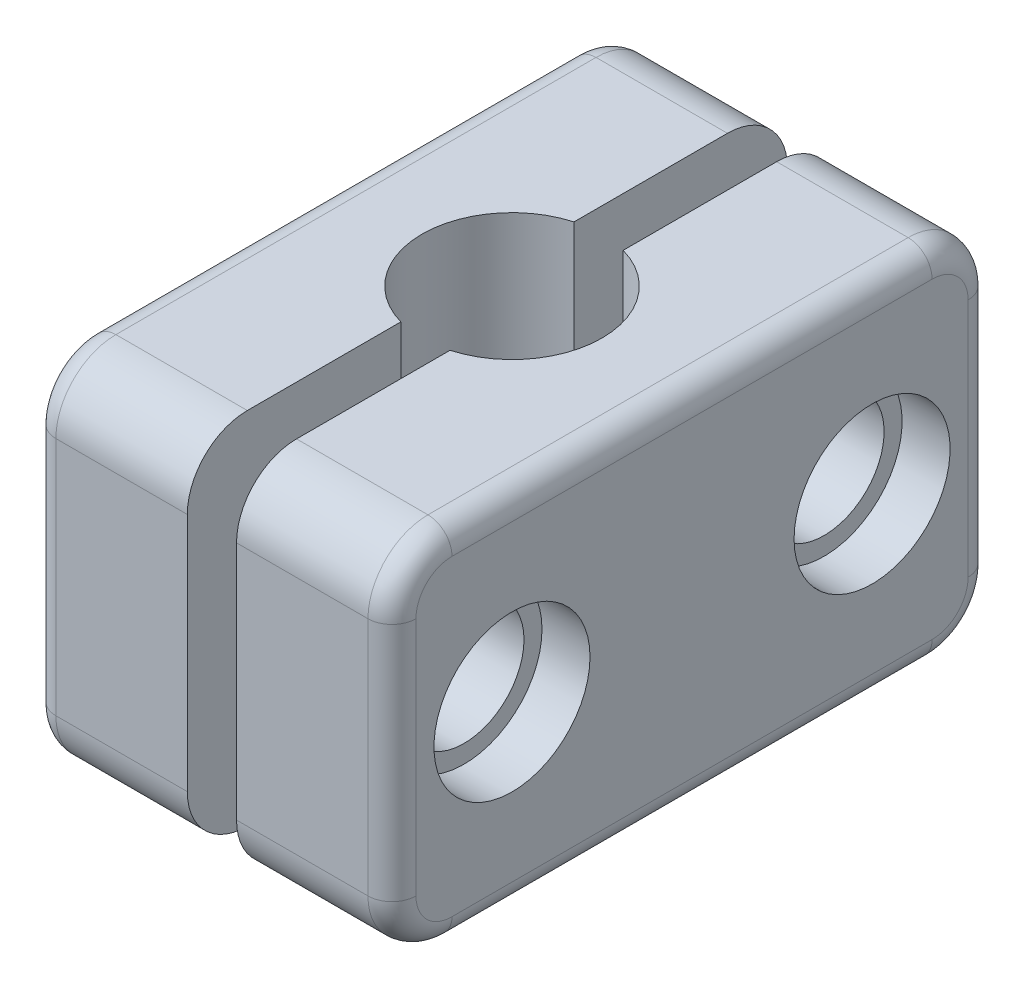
SolidWorks part; units mm, degrees
other "<Door Block Bracket>-<Cut-Extrude4[2]>"
other "<Door Block Bracket>-<Cut-Extrude4[1]>"
ref_plane "Front Plane" through (0, 0, 0) normal (0, 0, 1) x (1, 0, 0)
ref_plane "Top Plane" through (0, 0, 0) normal (0, 1, 0) x (1, 0, 0)
ref_plane "Right Plane" through (0, 0, 0) normal (1, 0, 0) x (0, 0, -1)
mirrored part "Door Block Bracket_Mirrored"
